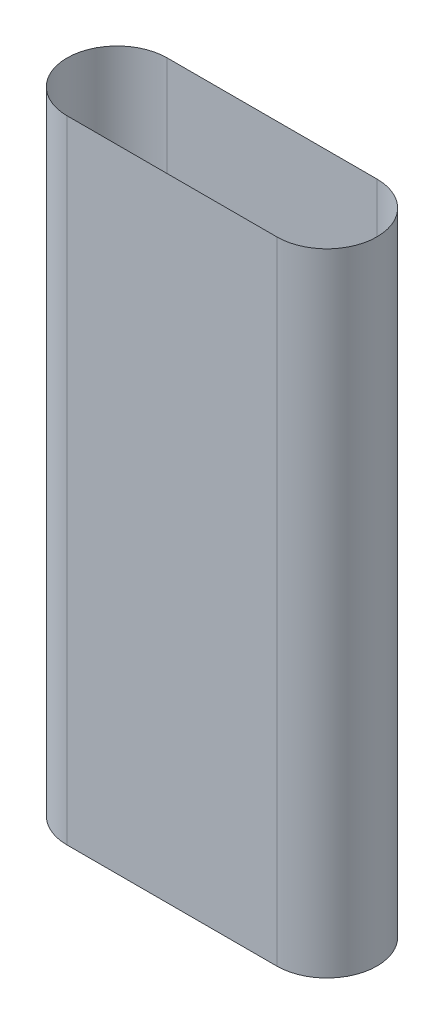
SolidWorks part; units mm, degrees
other "DetailItem5"
other "DetailItem6"
other "GridSystem1" parameters "D1"=400, "D2"=400, "D3"=0, "D4"=0
sketch "Sketch1" plane through (0, 0, 0) normal (0, 1, 0) x (1, 0, 0)
  line L0 (-66.4237, 0) -> (66.4237, 0) construction
  line L1 (-66.4237, 31.7328) -> (66.4237, 31.7328)
  line L2 (-66.4237, -31.7328) -> (66.4237, -31.7328)
  arc A0 (-66.4237, 31.7328) -> (-66.4237, -31.7328) centre (-66.4237, 0) ccw
  arc A1 (66.4237, -31.7328) -> (66.4237, 31.7328) centre (66.4237, 0) ccw
  point P2 (0, 0)
  point P8 (-66.4237, 31.7328)
  point P9 (66.4237, 31.7328)
  point P10 (-66.4237, -31.7328)
  point P11 (66.4237, -31.7328)
ref_plane "Level1" through (0, 100, 0) normal (0, 1, 0) x (1, 0, 0)
sketch "Sketch2" plane through (0, 100, 0) normal (0, 1, 0) x (1, 0, 0)
  line L0 (-66.4237, 0) -> (66.4237, 0) construction
  line L1 (-66.4237, 31.7328) -> (66.4237, 31.7328)
  line L2 (-66.4237, -31.7328) -> (66.4237, -31.7328)
  arc A0 (-66.4237, 31.7328) -> (-66.4237, -31.7328) centre (-66.4237, 0) ccw
  arc A1 (66.4237, -31.7328) -> (66.4237, 31.7328) centre (66.4237, 0) ccw
  point P2 (0, 0)
  point P8 (-66.4237, 31.7328)
  point P9 (66.4237, 31.7328)
  point P10 (-66.4237, -31.7328)
  point P11 (66.4237, -31.7328)
ref_plane "Level2" through (0, 200, 0) normal (0, 1, 0) x (1, 0, 0)
sketch "Sketch3" plane through (0, 200, 0) normal (0, 1, 0) x (1, 0, 0)
  line L0 (-66.4237, 0) -> (66.4237, 0) construction
  line L1 (-66.4237, 31.7328) -> (66.4237, 31.7328)
  line L2 (-66.4237, -31.7328) -> (66.4237, -31.7328)
  arc A0 (-66.4237, 31.7328) -> (-66.4237, -31.7328) centre (-66.4237, 0) ccw
  arc A1 (66.4237, -31.7328) -> (66.4237, 31.7328) centre (66.4237, 0) ccw
  point P2 (0, 0)
  point P8 (-66.4237, 31.7328)
  point P9 (66.4237, 31.7328)
  point P10 (-66.4237, -31.7328)
  point P11 (66.4237, -31.7328)
ref_plane "Level3" through (0, 300, 0) normal (0, 1, 0) x (1, 0, 0)
sketch "Sketch4" plane through (0, 300, 0) normal (0, 1, 0) x (1, 0, 0)
  line L0 (-66.4237, 0) -> (66.4237, 0) construction
  line L1 (-66.4237, 31.7328) -> (66.4237, 31.7328)
  line L2 (-66.4237, -31.7328) -> (66.4237, -31.7328)
  arc A0 (-66.4237, 31.7328) -> (-66.4237, -31.7328) centre (-66.4237, 0) ccw
  arc A1 (66.4237, -31.7328) -> (66.4237, 31.7328) centre (66.4237, 0) ccw
  point P2 (0, 0)
  point P8 (-66.4237, 31.7328)
  point P9 (66.4237, 31.7328)
  point P10 (-66.4237, -31.7328)
  point P11 (66.4237, -31.7328)
ref_plane "Level4" through (0, 400, 0) normal (0, 1, 0) x (1, 0, 0)
sketch "Sketch5" plane through (0, 400, 0) normal (0, 1, 0) x (1, 0, 0)
  line L0 (-66.4237, 0) -> (66.4237, 0) construction
  line L1 (-66.4237, 31.7328) -> (66.4237, 31.7328)
  line L2 (-66.4237, -31.7328) -> (66.4237, -31.7328)
  arc A0 (-66.4237, 31.7328) -> (-66.4237, -31.7328) centre (-66.4237, 0) ccw
  arc A1 (66.4237, -31.7328) -> (66.4237, 31.7328) centre (66.4237, 0) ccw
  point P2 (0, 0)
  point P8 (-66.4237, 31.7328)
  point P9 (66.4237, 31.7328)
  point P10 (-66.4237, -31.7328)
  point P11 (66.4237, -31.7328)
sketch3d "3DSketch1"
  line L0 (0, 0, 0) -> (0, 100, 0)
  line L1 (0, 100, 0) -> (0, 200, 0)
  line L2 (0, 200, 0) -> (0, 300, 0)
  line L3 (0, 300, 0) -> (0, 400, 0)
  line L4 (-66.4237, 0, -31.7328) -> (-66.4237, 100, -31.7328)
  line L5 (-66.4237, 100, -31.7328) -> (-66.4237, 200, -31.7328)
  line L6 (-66.4237, 200, -31.7328) -> (-66.4237, 300, -31.7328)
  line L7 (-66.4237, 300, -31.7328) -> (-66.4237, 400, -31.7328)
  line L8 (66.4237, 0, -31.7328) -> (66.4237, 100, -31.7328)
  line L9 (66.4237, 100, -31.7328) -> (66.4237, 200, -31.7328)
  line L10 (66.4237, 200, -31.7328) -> (66.4237, 300, -31.7328)
  line L11 (66.4237, 300, -31.7328) -> (66.4237, 400, -31.7328)
  line L12 (-66.4237, 0, 31.7328) -> (-66.4237, 100, 31.7328)
  line L13 (-66.4237, 100, 31.7328) -> (-66.4237, 200, 31.7328)
  line L14 (-66.4237, 200, 31.7328) -> (-66.4237, 300, 31.7328)
  line L15 (-66.4237, 300, 31.7328) -> (-66.4237, 400, 31.7328)
  line L16 (66.4237, 0, 31.7328) -> (66.4237, 100, 31.7328)
  line L17 (66.4237, 100, 31.7328) -> (66.4237, 200, 31.7328)
  line L18 (66.4237, 200, 31.7328) -> (66.4237, 300, 31.7328)
  line L19 (66.4237, 300, 31.7328) -> (66.4237, 400, 31.7328)
surface "Surface-Extrude1" sketch "Sketch1"
ref_plane "Front Plane" through (0, 0, 0) normal (0, 0, 1) x (1, 0, 0)
ref_plane "Top Plane" through (0, 0, 0) normal (0, 1, 0) x (1, 0, 0)
ref_plane "Right Plane" through (0, 0, 0) normal (1, 0, 0) x (0, 0, -1)
